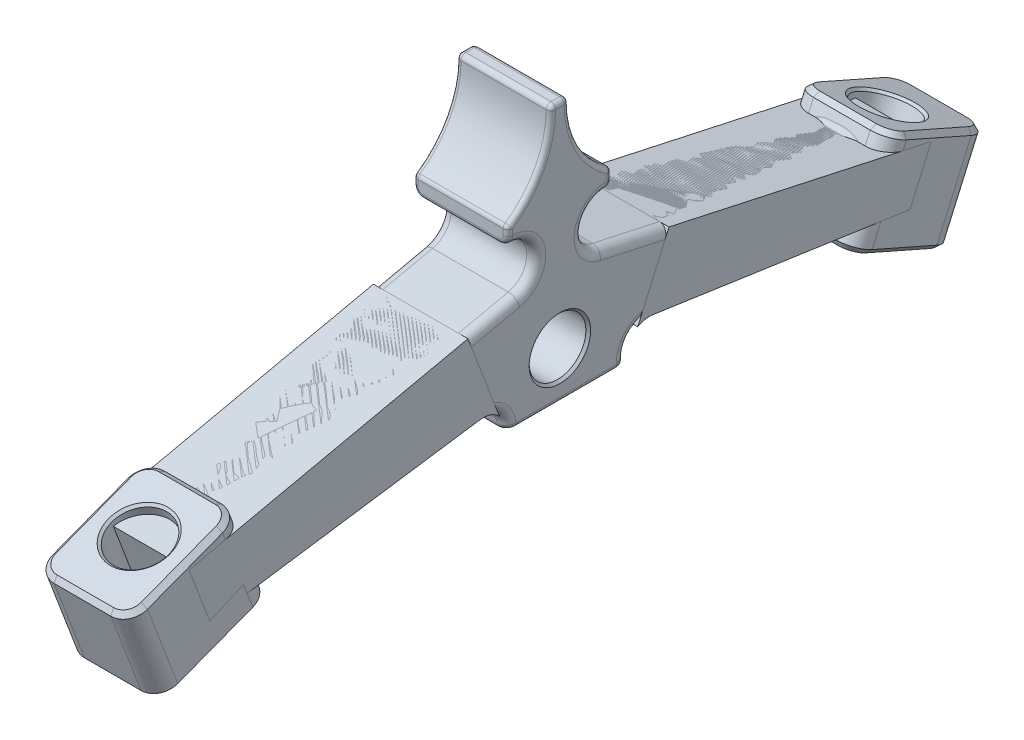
SolidWorks part; units mm, degrees
ref_plane "Спереди" through (0, 0, 0) normal (0, 0, 1) x (1, 0, 0)
ref_plane "Сверху" through (0, 0, 0) normal (0, 1, 0) x (1, 0, 0)
ref_plane "Справа" through (0, 0, 0) normal (1, 0, 0) x (0, 0, -1)
sketch "Эскиз1" plane through (0, 0, 0) normal (1, 0, 0) x (0, 0, -1)
  line L0 (-5.645, -5) -> (6.98, -5)
  line L1 (-5.645, -5) -> (-5.645, -4.8147)
  line L2 (6.98, -5) -> (6.98, -4.3294)
  line L3 (-8.5059, -2.3409) -> (0, -1.1) construction
  line L4 (-39.5, 0) -> (39.6, 0) construction
  line L5 (-8.5059, -2.3409) -> (-37.0264, -6.5016)
  line L6 (0, 7.845) -> (-4.4674, 6.8709) construction
  line L7 (0, -5) -> (0, 22.5586) construction
  line L8 (-2.5, 16.0747) -> (-2.5, 5.4293) construction
  line L9 (-4.4674, 6.8709) -> (-39.2304, -0.7086)
  line L10 (-5.5, 13.7136) -> (-5.5, 11.8136)
  line L11 (-5, 11.8136) -> (-5.5, 11.8136)
  line L12 (-0.95, 22.5586) -> (0.95, 22.5586)
  line L13 (-0.95, 22.5586) -> (-0.95, 22.0979)
  line L14 (5, 11.8136) -> (5.5, 11.8136)
  line L15 (5.5, 13.7136) -> (5.5, 11.8136)
  line L16 (0.95, 22.5586) -> (0.95, 22.0979)
  line L17 (4.4674, 6.8709) -> (39.2825, -0.72)
  line L18 (0, -0.42) -> (9.8409, -1.8556) construction
  line L19 (9.8409, -1.8556) -> (37.032, -5.8224)
  line L20 (39.2825, -0.72) -> (37.032, -5.8224)
  line L21 (-39.2304, -0.7086) -> (-37.0264, -6.5016)
  line L22 (-39.5, 19.2077) -> (-39.5, -34.1467) construction
  line L23 (39.6, 22.0979) -> (39.6, -34.1467) construction
  line L24 (11.536, 5.3298) -> (6.98, -5) construction
  line L25 (-9.7253, 5.7245) -> (-5.645, -5) construction
  line L26 (35.12, 1.9759) -> (44.08, -1.9759) construction
  line L27 (-32.699, 2.5875) -> (-46.301, -2.5875) construction
  circle A0 centre (0, 0) radius 3
  arc A1 (-5.645, -4.8147) -> (-8.5059, -2.3409) centre (-8.145, -4.8147) ccw
  arc A2 (-4.4674, 6.8709) -> (-5, 11.8136) centre (-5, 9.3136) ccw
  arc A3 (-5.5, 13.7136) -> (-0.95, 22.0979) centre (-10.95, 22.0979) ccw
  arc A4 (4.4674, 6.8709) -> (5, 11.8136) centre (5, 9.3136) cw
  arc A5 (5.5, 13.7136) -> (0.95, 22.0979) centre (10.95, 22.0979) cw
  arc A6 (9.8409, -1.8556) -> (6.98, -4.3294) centre (9.48, -4.3294) ccw
  dimension "D1" = 6
  dimension "D4" = 6.98
  dimension "D7" = 2.5
  dimension "D11" = 5
  dimension "D15" = 20
  dimension "D18" = 2.5
  dimension "D2" = 5
  dimension "D3" = 5.645
  dimension "D5" = 1.1
  dimension "D6" = 8.3
  dimension "D8" = 12.3
  dimension "D9" = 7.845
  dimension "D10" = 2.5
  dimension "D12" = 11
  dimension "D13" = 1.9
  dimension "D14" = 13.245
  dimension "D16" = 8.3
  dimension "D17" = 0.68
  dimension "D19" = 23.8
  dimension "D20" = 20.83
  dimension "D21" = 39.6
  dimension "D22" = 39.5
  dimension "D23" = 12.3
extrude "Бобышка-Вытянуть1" add sketch "Эскиз1" along normal blind 10
ref_plane "Плоскость1" through (0, -3.3915, -7.6895) normal (0, 0.4035, 0.915) x (1, 0, 0)
ref_plane "Плоскость2" through (0, -2.5084, 6.593) normal (0, 0.3556, -0.9346) x (-1, 0, 0)
split "Разделить1" trim tools "Плоскость1", "Плоскость2" bodies to split 101 resulting bodies 102 103 104
fillet "Скругление1" radius 1 20 edges at (0, 11.8136, 5.25) (0, 9.5814, 2.5144) (0, -4.9073, 5.645) (10, 11.8136, 5.25) (10, 9.5814, 2.5144) (10, -4.9073, 5.645) (10, -4.6647, -6.98) (0, 11.8136, -5.25) (0, 9.5814, -2.5144) (10, 11.8136, -5.25) (10, 9.5814, -2.5144) (0, 6.2977, 7.0964) (0, -3.8467, 5.84) (10, 6.2977, 7.0964) (10, -3.8467, 5.84) (10, -3.079, -7.3152) (0, 6.1003, -8.0017) (10, 6.1003, -8.0017) (0, -4.6647, -6.98) (0, -3.079, -7.3152)
sketch "Эскиз3" plane through (0, -14.6214, -33.1512) normal (0, -0.4035, -0.915) x (-1, 0, 0)
  line L0 (-10, 15.1935) -> (0, 9.6168) construction
  line L1 (0, 15.1935) -> (-10, 9.6168) construction
  line L3 (-4.9, 9.6168) -> (-5.1, 9.6168)
  line L4 (0, 9.6168) -> (0, 15.1935)
  line L5 (0, 15.1935) -> (-10, 15.1935)
  line L6 (-10, 15.1935) -> (-10, 9.6168)
  line L7 (-10, 9.6168) -> (0, 9.6168)
  line L8 (0, 9.6168) -> (0, 15.1935) construction
  line L9 (0, 15.1935) -> (-10, 15.1935) construction
  line L10 (-10, 15.1935) -> (-10, 9.6168) construction
  line L11 (-10, 9.6168) -> (0, 9.6168) construction
  line L12 (-2.5, 12.0168) -> (-2.5, 12.7935)
  line L13 (-4.9, 15.1935) -> (-5.1, 15.1935)
  line L14 (-7.5, 12.0168) -> (-7.5, 12.7935)
  line L15 (-2.5, 9.6168) -> (-7.5, 15.1935) construction
  line L16 (-2.5, 15.1935) -> (-7.5, 9.6168) construction
  arc A0 (-2.5, 12.7935) -> (-4.9, 15.1935) centre (-4.9, 12.7935) ccw
  arc A1 (-4.9, 9.6168) -> (-2.5, 12.0168) centre (-4.9, 12.0168) ccw
  arc A2 (-5.1, 9.6168) -> (-7.5, 12.0168) centre (-5.1, 12.0168) cw
  arc A3 (-5.1, 15.1935) -> (-7.5, 12.7935) centre (-5.1, 12.7935) ccw
  point P2 (-5, 12.4052)
  point P16 (-5, 12.4052)
  dimension "D2" = 5
  dimension "D3" = 2.4
  dimension "D1" = 0
sketch "Эскиз5" plane through (0, -3.3915, -7.6895) normal (0, 0.4035, 0.915) x (1, 0, 0)
  line L0 (9, 9.5318) -> (1, 9.5318)
  line L1 (9, 1.3417) -> (1, 1.3417)
  line L2 (10, 2.7249) -> (10, 8.5113)
  line L3 (0, 2.7249) -> (0, 8.5113)
  line L4 (10, 8.5113) -> (0, 2.7249) construction
  line L5 (0, 8.5113) -> (10, 2.7249) construction
  ellipse E0 centre (9, 8.5113) end of major axis (9, 7.4908) minor radius 1 (10, 8.5113) -> (9, 9.5318) ccw construction
  ellipse E1 centre (1, 8.5113) end of major axis (1, 7.4908) minor radius 1 (1, 9.5318) -> (0, 8.5113) ccw construction
  ellipse E2 centre (9, 8.5113) end of major axis (9, 9.5318) minor radius 1 (10, 8.5113) -> (9, 9.5318) ccw
  ellipse E3 centre (1, 8.5113) end of major axis (1, 7.4908) minor radius 1 (1, 9.5318) -> (0, 8.5113) ccw
  spline S0 degree 3 poles (-1957.6092, 360.4779) (-117.644, 48.2402) (13.5161, 14.2821) (9.8874, 2.1182) (9.8233, 1.9767) (9.6571, 1.7158) (9.5553, 1.5956) (4.8349, -1.9777) (-31.9765, 34.3681) (637.7299, 1899.4583) knots -19.908318 -19.908318 -19.908318 -19.908318 0.25 0.25 0.5 0.5 0.75 0.75 9.962525 9.962525 9.962525 9.962525 only from (10, 2.7249) to (9, 1.3417) construction
  spline S1 degree 3 poles (-596.4859, 1909.526) (41.7803, 34.4793) (5.1726, -1.9804) (0.4452, 1.5952) (0.344, 1.7142) (0.1766, 1.9768) (0.1132, 2.117) (-2.9919, 12.4875) (90.0976, 50.7268) (1534.1203, -1278.1635) knots -8.98353 -8.98353 -8.98353 -8.98353 0.25 0.25 0.5 0.5 0.75 0.75 17.947758 17.947758 17.947758 17.947758 only from (1, 1.3417) to (0, 2.7249) construction
  spline S2 degree 3 poles (10, 2.7249) (10, 2.5686) (9.9763, 2.4162) (9.8874, 2.1182) (9.8233, 1.9767) (9.6571, 1.7158) (9.5553, 1.5956) (9.3058, 1.4068) (9.1574, 1.3417) (9, 1.3417) knots 0 0 0 0 0.25 0.25 0.5 0.5 0.75 0.75 1 1 1 1
  spline S3 degree 3 poles (1, 1.3417) (0.8425, 1.3417) (0.6944, 1.4067) (0.4452, 1.5952) (0.344, 1.7142) (0.1766, 1.9768) (0.1132, 2.117) (0.0242, 2.4142) (0, 2.5687) (0, 2.7249) knots 0 0 0 0 0.25 0.25 0.5 0.5 0.75 0.75 1 1 1 1
  point P26 (5, 5.6181)
ref_plane "Плоскость3" through (5, 0, 0) normal (1, 0, 0) x (0, 0, -1)
loft "По сечениям5" add profiles "Эскиз5", "Эскиз3"
sketch "Эскиз8" plane through (0, -2.5084, 6.593) normal (0, 0.3556, -0.9346) x (-1, 0, 0)
  line L4 (-1, 8.8087) -> (-9, 8.8087)
  line L5 (0, 1.0598) -> (0, 7.7975)
  line L6 (-9, -0.5578) -> (-1, -0.5578)
  line L7 (-10, 7.7975) -> (-10, 1.0598)
  line L8 (-1, 8.8087) -> (-9, 8.8087)
  line L9 (0, 1.0598) -> (0, 7.7975)
  line L10 (-9, -0.5578) -> (-1, -0.5578)
  line L11 (-10, 7.7975) -> (-10, 1.0598)
  ellipse E2 centre (-1, 7.7975) end of major axis (-1, 8.8087) minor radius 1 (0, 7.7975) -> (-1, 8.8087) ccw
  ellipse E3 centre (-9, 7.7975) end of major axis (-9, 8.8087) minor radius 1 (-9, 8.8087) -> (-10, 7.7975) ccw
  ellipse E4 centre (-1, 7.7975) end of major axis (-1, 8.8087) minor radius 1 (0, 7.7975) -> (-1, 8.8087) ccw
  ellipse E5 centre (-9, 7.7975) end of major axis (-9, 8.8087) minor radius 1 (-9, 8.8087) -> (-10, 7.7975) ccw
  spline S2 degree 3 poles (1021.352, 2819.2428) (-40.4069, 40.2396) (-4.9836, -2.8988) (-0.6822, -0.4453) (-0.6163, -0.3901) (-0.4359, -0.2075) (-0.3386, -0.0647) (-0.1778, 0.2333) (-0.1136, 0.393) (3.427, 13.4686) (-114.2925, 47.3532) (-2948.8139, 551.3045) knots -7.032925 -7.032925 -7.032925 -7.032925 0.125 0.125 0.25 0.25 0.5 0.5 0.75 0.75 20.441268 20.441268 20.441268 20.441268 only from (-1, -0.5578) to (0, 1.0598)
  spline S3 degree 3 poles (2954.5109, 459.8719) (114.8926, 45.9877) (-13.5732, 13.9678) (-9.8855, 0.3903) (-9.8221, 0.2333) (-9.6616, -0.0645) (-9.564, -0.2075) (-9.3848, -0.3891) (-9.3182, -0.4451) (-4.9856, -2.9179) (30.2791, 41.2638) (-1052.9568, 2811.3668) knots -20.061024 -20.061024 -20.061024 -20.061024 0.25 0.25 0.5 0.5 0.75 0.75 0.875 0.875 8.064881 8.064881 8.064881 8.064881 only from (-10, 1.0598) to (-9, -0.5578)
  spline S4 degree 3 poles (-1, -0.5578) (-0.9132, -0.5578) (-0.8298, -0.5295) (-0.6822, -0.4453) (-0.6163, -0.3901) (-0.4359, -0.2075) (-0.3386, -0.0647) (-0.1778, 0.2333) (-0.1136, 0.393) (-0.0249, 0.7209) (0, 0.8882) (0, 1.0598) knots 0 0 0 0 0.125 0.125 0.25 0.25 0.5 0.5 0.75 0.75 1 1 1 1
  spline S5 degree 3 poles (-10, 1.0598) (-10, 0.8884) (-9.9752, 0.7205) (-9.8855, 0.3903) (-9.8221, 0.2333) (-9.6616, -0.0645) (-9.564, -0.2075) (-9.3848, -0.3891) (-9.3182, -0.4451) (-9.1702, -0.5296) (-9.0867, -0.5578) (-9, -0.5578) knots 0 0 0 0 0.25 0.25 0.5 0.5 0.75 0.75 0.875 0.875 1 1 1 1
  dimension "D1" = 0
sketch "Эскиз9" plane through (0, -13.128, 34.5053) normal (0, -0.3556, 0.9346) x (1, 0, 0)
  line L0 (2, 13.2879) -> (8, 7.0898) construction
  line L1 (8, 13.2879) -> (2, 7.0898) construction
  line L3 (5.5, 13.2879) -> (4.5, 13.2879)
  line L4 (0, 13.2879) -> (0, 7.0898)
  line L5 (0, 7.0898) -> (10, 7.0898)
  line L6 (10, 7.0898) -> (10, 13.2879)
  line L7 (10, 13.2879) -> (0, 13.2879)
  line L8 (0, 11.2879) -> (0, 9.0898) construction
  line L9 (2, 7.0898) -> (8, 7.0898) construction
  line L10 (10, 9.0898) -> (10, 11.2879) construction
  line L11 (8, 13.2879) -> (2, 13.2879) construction
  line L12 (7.5, 11.2879) -> (7.5, 9.0898)
  line L13 (5.5, 7.0898) -> (4.5, 7.0898)
  line L14 (2.5, 11.2879) -> (2.5, 9.0898)
  line L15 (7.5, 13.2879) -> (2.5, 7.0898) construction
  line L16 (7.5, 7.0898) -> (2.5, 13.2879) construction
  arc A0 (0, 9.0898) -> (2, 7.0898) centre (2, 9.0898) ccw construction
  arc A1 (0, 11.2879) -> (2, 13.2879) centre (2, 11.2879) cw construction
  arc A2 (10, 11.2879) -> (8, 13.2879) centre (8, 11.2879) ccw construction
  arc A3 (8, 7.0898) -> (10, 9.0898) centre (8, 9.0898) ccw construction
  arc A4 (5.5, 13.2879) -> (7.5, 11.2879) centre (5.5, 11.2879) cw
  arc A5 (7.5, 9.0898) -> (5.5, 7.0898) centre (5.5, 9.0898) cw
  arc A6 (4.5, 7.0898) -> (2.5, 9.0898) centre (4.5, 9.0898) cw
  arc A7 (4.5, 13.2879) -> (2.5, 11.2879) centre (4.5, 11.2879) ccw
  point P16 (5, 10.1889)
  dimension "D2" = 2
  dimension "D4" = 2
  dimension "D3" = 5
  dimension "D1" = 0
loft "По сечениям6" add profiles "Эскиз8", "Эскиз9"
fillet "Скругление2" radius 0.5 26 edges at (10, 13.2636, 5.5) (9.7071, 12.1065, 5.5) (5, 11.8136, 5.5) (0.2929, 12.1065, 5.5) (0, 13.2636, 5.5) (9.7071, 12.1065, -5.5) (10, 13.2636, -5.5) (0, 13.2636, -5.5) (0.2929, 12.1065, -5.5) (5, 11.8136, -5.5) (10, 17.3282, 2.1608) (5, 13.7136, 5.5) (0, 17.3282, 2.1608) (5, 13.7136, -5.5) (10, 17.3282, -2.1608) (0, 17.3282, -2.1608) (0.2929, -5, 5.3521) (5, -5, 5.645) (9.7071, -5, 5.3521) (10, -5, -0.6675) (9.7071, -5, -6.6871) (5, -5, -6.98) (0.2929, -5, -6.6871) (0, -5, -0.6675) (0, 22.5586, 0) (10, 22.5586, 0)
fillet "Скругление3" radius 0.5 6 edges at (5, 22.5586, 0.95) (5, 22.5586, -0.95)
ref_plane "Плоскость4" through (10, 0, 0) normal (1, 0, 0) x (0, 0, -1)
sketch "Эскиз10" plane through (10, 0, 0) normal (1, 0, 0) x (0, 0, -1)
  line L0 (35.12, 1.9759) -> (44.08, -1.9759) construction
  line L1 (35.12, 1.9759) -> (44.08, -1.9759)
  line L2 (-32.699, 2.5875) -> (-46.301, -2.5875) construction
  line L3 (-32.699, 2.5875) -> (-46.301, -2.5875)
ref_plane "Плоскость5" through (0, 14.6214, -6.4488) normal (0, 0.915, -0.4035) x (-1, 0, 0)
sketch "Эскиз11" plane through (0, 14.6214, -6.4488) normal (0, 0.915, -0.4035) x (-1, 0, 0)
  line L0 (-5, -36.2324) -> (-5, -26.7912) construction
  line L1 (-2, -31.2324) -> (-8, -31.2324)
  line L2 (0, -33.2324) -> (0, -40.7324)
  line L3 (-2, -42.7324) -> (-8, -42.7324)
  line L4 (-10, -33.2324) -> (-10, -40.7324)
  line L5 (0, -31.2324) -> (-10, -42.7324) construction
  line L6 (0, -42.7324) -> (-10, -31.2324) construction
  line L7 (-4.9, -36.2324) -> (-5.1, -36.2324) construction
  arc A0 (-2, -31.2324) -> (0, -33.2324) centre (-2, -33.2324) cw
  arc A1 (0, -40.7324) -> (-2, -42.7324) centre (-2, -40.7324) cw
  arc A2 (-8, -42.7324) -> (-10, -40.7324) centre (-8, -40.7324) cw
  arc A3 (-8, -31.2324) -> (-10, -33.2324) centre (-8, -33.2324) ccw
  point P0 (-5, -36.9824)
  dimension "D4" = 2
  dimension "D1" = 11.5
  dimension "D2" = 5
  dimension "D3" = 10
extrude "Бобышка-Вытянуть2" add sketch "Эскиз11" against normal blind 10
sketch "Эскиз13" plane through (0, 14.6214, -6.4488) normal (0, 0.915, -0.4035) x (-1, 0, 0)
  circle A0 centre (-5, -36.2324) radius 3
  dimension "D1" = 6
extrude "Вырез-Вытянуть1" cut sketch "Эскиз13" against normal blind 10
chamfer "Фаска1" distance 0.5 angle 45 16 edges at (0, -9.4523, -36.2508) (0.5858, -7.3683, -31.5257) (0.5858, -11.5362, -40.9758) (5, -7.1319, -30.9897) (5, -11.7726, -41.5118) (9.4142, -7.3683, -31.5257) (9.4142, -11.5362, -40.9758) (10, -9.4523, -36.2508) (0, -0.3027, -40.2862) (0.5858, 1.7813, -35.5612) (0.5858, -2.3867, -45.0113) (5, 2.0177, -35.0252) (5, -2.623, -45.5472) (9.4142, 1.7813, -35.5612) (9.4142, -2.3867, -45.0113) (10, -0.3027, -40.2862)
chamfer "Фаска2" distance 0.25 angle 45 4 edges at (0, 0, -3) (10, 0, -3) (5, 1.2106, -36.8551) (5, -7.939, -32.8197)
fillet "Скругление4" radius 0.5 1 edges at (4.6041, 0.367, -34.2971)
ref_plane "Плоскость6" through (0, 13.128, 4.9947) normal (0, 0.9346, 0.3556) x (-1, 0, 0)
sketch "Эскиз14" plane through (0, 13.128, 4.9947) normal (0, 0.9346, 0.3556) x (-1, 0, 0)
  line L1 (-2, 43.5183) -> (-8, 43.5183)
  line L2 (0, 41.5183) -> (0, 33.0183)
  line L3 (-2, 31.0183) -> (-8, 31.0183)
  line L4 (-10, 41.5183) -> (-10, 33.0183)
  line L5 (0, 43.5183) -> (-10, 31.0183) construction
  line L6 (0, 31.0183) -> (-10, 43.5183) construction
  line L7 (-5.5, 36.9183) -> (-4.5, 36.9183) construction
  line L8 (-5.5, 36.9183) -> (-4.5, 36.9183) construction
  line L9 (-5, 36.9183) -> (-5, 42.706) construction
  arc A0 (-2, 43.5183) -> (0, 41.5183) centre (-2, 41.5183) cw
  arc A1 (0, 33.0183) -> (-2, 31.0183) centre (-2, 33.0183) cw
  arc A2 (-8, 31.0183) -> (-10, 33.0183) centre (-8, 33.0183) cw
  arc A3 (-8, 43.5183) -> (-10, 41.5183) centre (-8, 41.5183) ccw
  point P0 (-5, 37.2683)
  dimension "D4" = 2
  dimension "D1" = 10
  dimension "D2" = 12.5
  dimension "D3" = 5.9
extrude "Бобышка-Вытянуть3" add sketch "Эскиз14" against normal blind 10
sketch "Эскиз15" plane through (0, 13.128, 4.9947) normal (0, 0.9346, 0.3556) x (-1, 0, 0)
  circle A0 centre (-5, 36.9183) radius 3
  dimension "D1" = 6
extrude "Вырез-Вытянуть2" cut sketch "Эскиз15" against normal blind 10
chamfer "Фаска3" distance 0.25 angle 45 2 edges at (5, -1.0668, 42.3039) (5, -10.4132, 38.748)
chamfer "Фаска4" distance 0.5 angle 45 16 edges at (0, -9.4709, 36.2712) (0.5858, -11.485, 41.5652) (0.5858, -7.4567, 30.9772) (5, -11.6933, 42.1127) (5, -7.2484, 30.4297) (9.4142, -11.485, 41.5652) (9.4142, -7.4567, 30.9772) (10, -9.4709, 36.2712) (0, -0.1245, 39.8271) (0.5858, -2.1386, 45.1211) (0.5858, 1.8897, 34.5331) (5, -2.3469, 45.6686) (5, 2.098, 33.9856) (9.4142, -2.1386, 45.1211) (9.4142, 1.8897, 34.5331) (10, -0.1245, 39.8271)
fillet "Скругление5" radius 0.5 1 edges at (3.1396, 0.4388, 33.3544)
